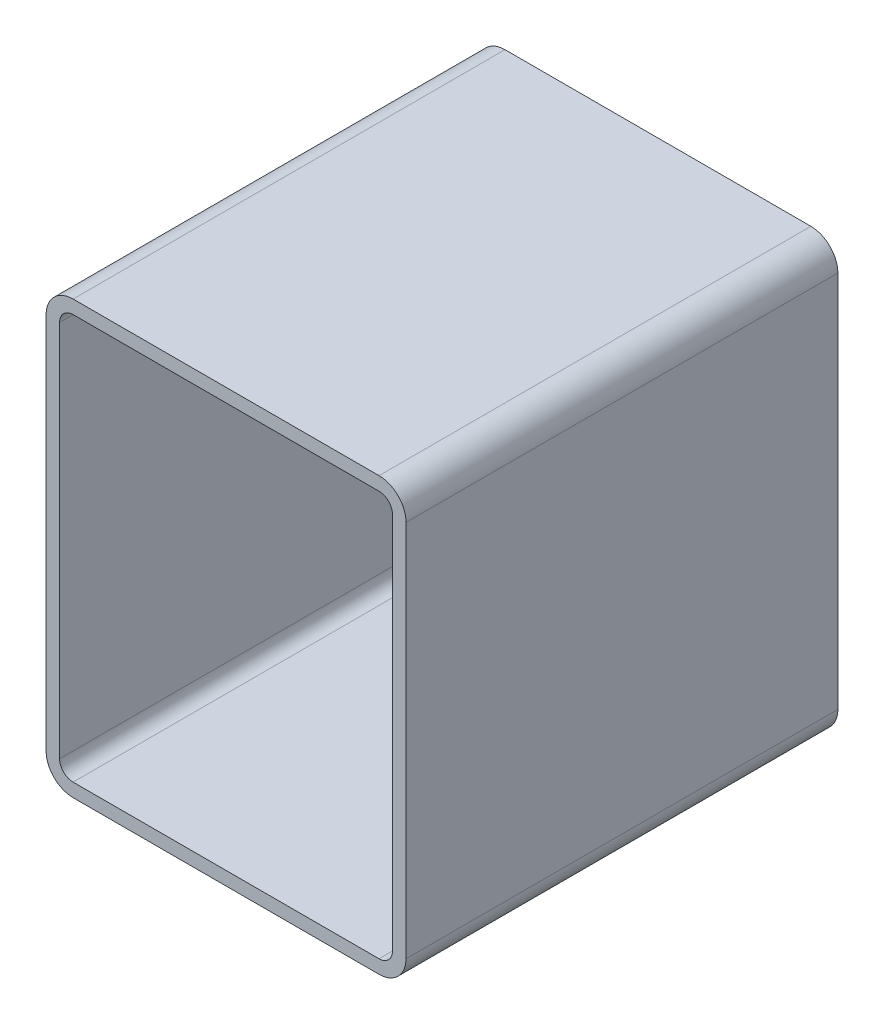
SolidWorks part; units mm, degrees
ref_plane "Front Plane" through (0, 0, 0) normal (0, 0, 1) x (1, 0, 0)
ref_plane "Top Plane" through (0, 0, 0) normal (0, 1, 0) x (1, 0, 0)
ref_plane "Right Plane" through (0, 0, 0) normal (1, 0, 0) x (0, 0, -1)
sketch "Sketch1" plane through (0, 0, 0) normal (0, 0, 1) x (1, 0, 0)
sketch_block_instance "HSS12x10x0.375-1"
sketch_block "HSS12x10x0.375"
extrude "Boss-Extrude1" add sketch "Sketch1" along normal blind 304.8
